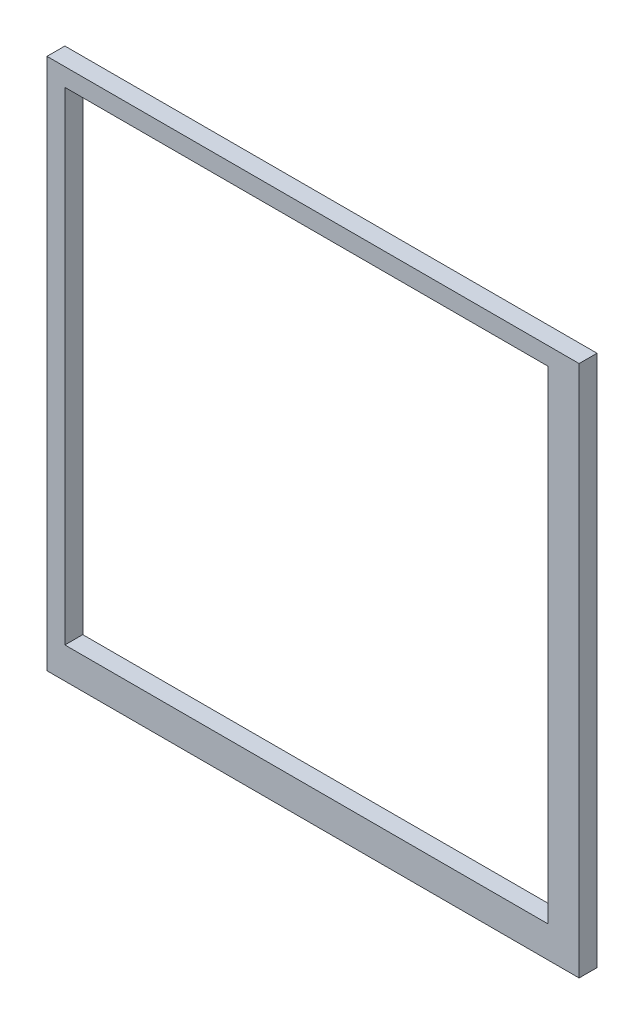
SolidWorks part; units mm, degrees
ref_plane "Front Plane" through (0, 0, 0) normal (0, 0, 1) x (1, 0, 0)
ref_plane "Top Plane" through (0, 0, 0) normal (0, 1, 0) x (1, 0, 0)
ref_plane "Right Plane" through (0, 0, 0) normal (1, 0, 0) x (0, 0, -1)
sketch "Sketch1" plane through (0, 0, 0) normal (0, 0, 1) x (1, 0, 0)
  line L0 (-290, 290) -> (-290, -305)
  line L1 (-270, 270) -> (270, 270)
  line L2 (-270, 270) -> (-270, -270)
  line L3 (-270, -270) -> (270, -270)
  line L4 (270, 270) -> (270, -270)
  line L5 (-270, 270) -> (270, -270) construction
  line L6 (-270, -270) -> (270, 270) construction
  line L7 (-290, 290) -> (305, 290)
  line L8 (305, 290) -> (305, -305)
  line L9 (-290, -305) -> (305, -305)
  line L10 (305, 270) -> (305, -305) construction
  line L11 (-290, 290) -> (270, 290) construction
  line L12 (-270, -305) -> (305, -305) construction
  line L13 (-290, 290) -> (-290, -270) construction
  point P0 (0, 0)
  dimension "D1" = 540
  dimension "D2" = 20
  dimension "D3" = 35
extrude "Boss-Extrude1" add sketch "Sketch1" along normal blind 20
